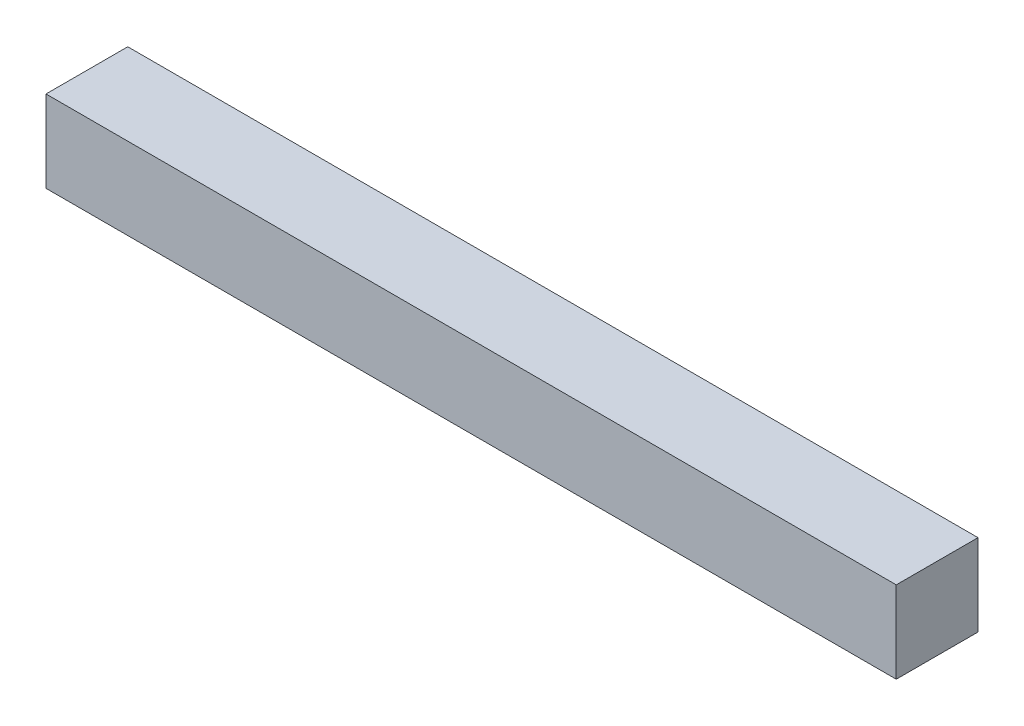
SolidWorks part; units mm, degrees
ref_plane "Front Plane" through (0, 0, 0) normal (0, 0, 1) x (1, 0, 0)
ref_plane "Top Plane" through (0, 0, 0) normal (0, 1, 0) x (1, 0, 0)
ref_plane "Right Plane" through (0, 0, 0) normal (1, 0, 0) x (0, 0, -1)
sketch "Sketch1" plane through (0, 0, 0) normal (0, 1, 0) x (1, 0, 0)
  line L1 (0, 0) -> (33.02, 0)
  line L2 (0, 0) -> (0, 3.175)
  line L3 (0, 3.175) -> (33.02, 3.175)
  line L4 (33.02, 0) -> (33.02, 3.175)
extrude "Boss-Extrude1" add sketch "Sketch1" along normal blind 3.175
